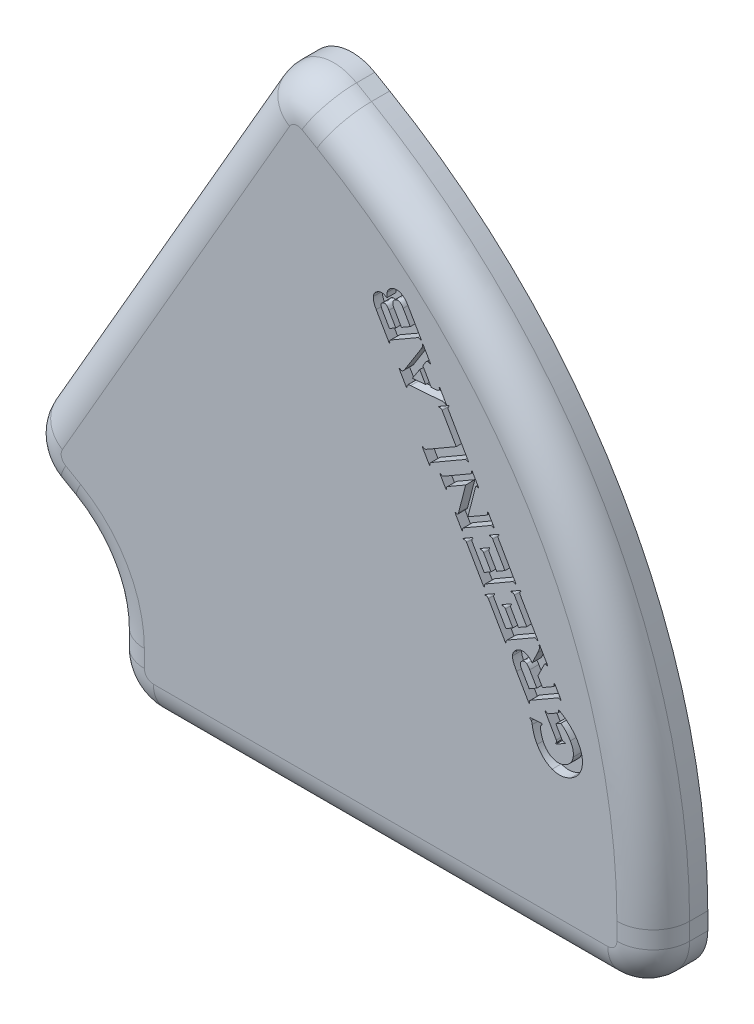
SolidWorks part; units mm, degrees
ref_plane "Front Plane" through (0, 0, 0) normal (0, 0, 1) x (1, 0, 0)
ref_plane "Top Plane" through (0, 0, 0) normal (0, 1, 0) x (1, 0, 0)
ref_plane "Right Plane" through (0, 0, 0) normal (1, 0, 0) x (0, 0, -1)
ref_plane "Plane1" through (0, 0, 3) normal (0, 0, 1) x (1, 0, 0)
sketch "Sketch1" plane through (0, 0, 3) normal (0, 0, 1) x (1, 0, 0)
  line L0 (15, -15) -> (15, 8.6603)
  line L1 (15, 8.6603) -> (-5.4904, 20.4904)
  line L2 (-5.4904, 20.4904) -> (-20.4904, -5.4904)
  line L3 (-20.4904, -5.4904) -> (-15, -8.6603)
  line L4 (-15, -8.6603) -> (-15, -15)
  line L5 (-15, -15) -> (15, -15)
  dimension "D1" = 20.4904
  dimension "D2" = 30
  dimension "D3" = 35.4904
  dimension "D4" = 6.3397
  dimension "D5" = 9.5096
  dimension "D6" = 23.6603
  dimension "D7" = 35.4904
extrude "Boss-Extrude1" add sketch "Sketch1" against normal blind 3
fillet "Fillet1" radius 2.5 4 edges at (-5.4904, 20.4904, 1.5) (-20.4904, -5.4904, 1.5) (15, -15, 1.5) (-15, -15, 1.5)
fillet "Fillet2" radius 5 1 edges at (-15, -8.6603, 1.5)
fillet "Fillet3" radius 35 1 edges at (15, 8.6603, 1.5)
fillet "Fillet4" radius 2 12 edges at (-15.6699, -9.047, 3) (-17.9127, -6.9786, 3) (-15, -12.0235, 3) (-19.4901, -5.2224, 3) (-14.2678, -14.2678, 3) (-12.9904, 7.5, 3) (0, -15, 3) (-5.2224, 19.4901, 3) (14.2678, -14.2678, 3) (-2.9127, 19.0022, 3) (15, -12.0235, 3) (10.3109, 5.953, 3)
sketch "Sketch2" plane through (0, 0, 3) normal (0, 0, 1) x (1, 0, 0)
  line L0 (12.5, -13) -> (-5.0083, 17.3253) construction
  line L1 (3.7458, 2.1627) -> (43305.0148, 25002.1647) construction
  line L2 (-3.2774, 20.3273) -> (15.9652, -13.0019) construction
  text T0 "GreenLab" font "Copperplate Gothic Bold" height 2.5
  point P6 (3.7458, 2.1627)
  point P10 (6.3439, 3.6627)
  dimension "D1" = 3
extrude "Cut-Extrude1" cut sketch "Sketch2" against normal blind 0.5
